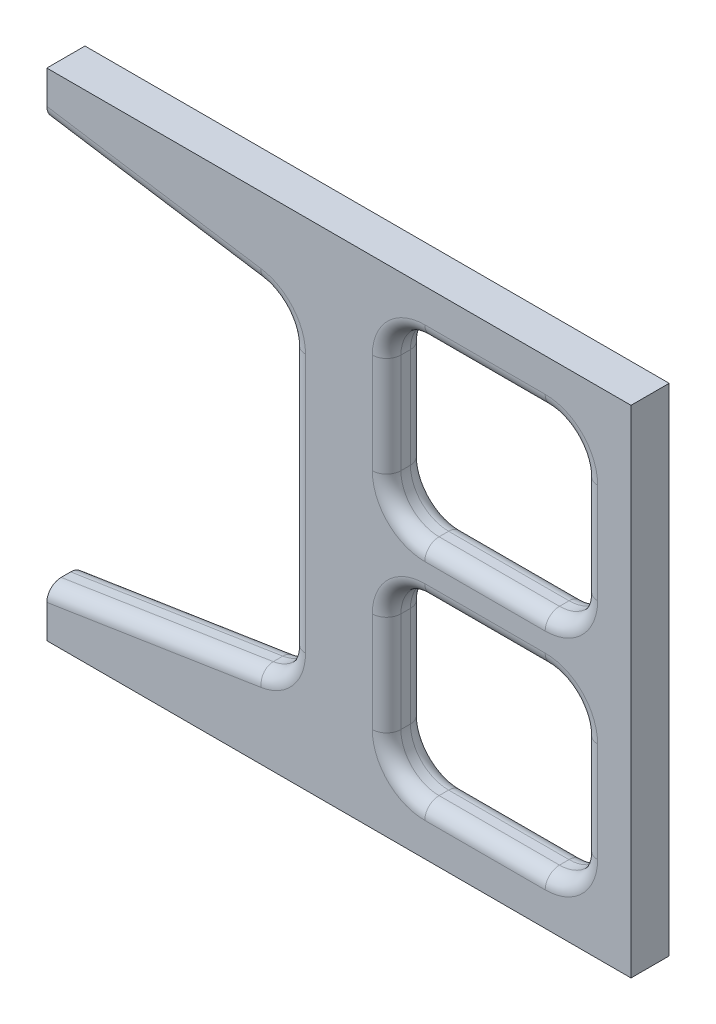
SolidWorks part; units mm, degrees
ref_plane "Спереди" through (0, 0, 0) normal (0, 0, 1) x (1, 0, 0)
ref_plane "Сверху" through (0, 0, 0) normal (0, 1, 0) x (1, 0, 0)
ref_plane "Справа" through (0, 0, 0) normal (1, 0, 0) x (0, 0, -1)
sketch "Эскиз1" plane through (0, 0, 0) normal (0, 0, 1) x (1, 0, 0)
  line L0 (-20, -54.3038) -> (-20, 54.3038)
  line L1 (-122.5, 104) -> (122.5, 104)
  line L2 (-122.5, 104) -> (-122.5, 84)
  line L3 (-122.5, -104) -> (122.5, -104)
  line L4 (122.5, 104) -> (122.5, -104)
  line L5 (-33.5323, 70.1124) -> (-122.5, 84)
  line L6 (-33.5323, -70.1124) -> (-122.5, -84)
  line L7 (-122.5, -84) -> (-122.5, -104)
  line L8 (102.5, 68) -> (102.5, 26)
  line L9 (36, 10) -> (86.5, 10)
  line L10 (-122.5, 104) -> (-122.5, -104) construction
  line L11 (20, 68) -> (20, 26)
  line L12 (36, 84) -> (86.5, 84)
  line L13 (36, -84) -> (86.5, -84)
  line L14 (-102.5, 84) -> (102.5, 84) construction
  line L15 (-102.5, 84) -> (-102.5, -84) construction
  line L16 (-102.5, -84) -> (102.5, -84) construction
  line L17 (102.5, 84) -> (102.5, -84) construction
  line L18 (36, -10) -> (86.5, -10)
  line L19 (20, -26) -> (20, -68)
  line L20 (102.5, -26) -> (102.5, -68)
  arc A0 (-20, 54.3038) -> (-33.5323, 70.1124) centre (-36, 54.3038) ccw
  arc A1 (-20, -54.3038) -> (-33.5323, -70.1124) centre (-36, -54.3038) cw
  arc A2 (36, 10) -> (20, 26) centre (36, 26) cw
  arc A3 (86.5, 10) -> (102.5, 26) centre (86.5, 26) ccw
  arc A4 (20, 68) -> (36, 84) centre (36, 68) cw
  arc A5 (102.5, 68) -> (86.5, 84) centre (86.5, 68) ccw
  arc A6 (86.5, -84) -> (102.5, -68) centre (86.5, -68) ccw
  arc A7 (20, -68) -> (36, -84) centre (36, -68) ccw
  arc A8 (36, -10) -> (20, -26) centre (36, -26) ccw
  arc A9 (86.5, -10) -> (102.5, -26) centre (86.5, -26) cw
  point P0 (0, 0)
  point P10 (-122.5, 84)
  point P11 (-122.5, -84)
  point P18 (-20, 68)
  point P19 (-20, -68)
  point P22 (-20, 68)
  point P34 (20, -84)
  point P36 (-20, -68)
  point P49 (102.5, -10)
  dimension "D4" = 16
  dimension "D5" = 16
  dimension "D6" = 16
  dimension "D7" = 16
  dimension "D8" = 16
  dimension "D9" = 16
  dimension "D10" = 16
  dimension "D11" = 16
  dimension "D3" = 16
  dimension "D12" = 16
  dimension "D1" = 245
  dimension "D2" = 208
extrude "Бобышка-Вытянуть1" add sketch "Эскиз1" along normal blind 16
fillet "Скругление2" radius 6 16 edges at (24.6863, 79.3137, 0) (61.25, 84, 0) (97.8137, 79.3137, 0) (102.5, 47, 0) (24.6863, 79.3137, 16) (61.25, 84, 16) (97.8137, 79.3137, 16) (102.5, 47, 16) (20, 47, 0) (20, 47, 16) (97.8137, 14.6863, 0) (61.25, 10, 0) (24.6863, 14.6863, 0) (97.8137, 14.6863, 16) (61.25, 10, 16) (24.6863, 14.6863, 16)
fillet "Скругление3" radius 6 10 edges at (-78.0162, 77.0562, 0) (-23.8451, 64.7085, 0) (-78.0162, -77.0562, 0) (-23.8451, -64.7085, 0) (-78.0162, -77.0562, 16) (-23.8451, -64.7085, 16) (-20, 0, 16) (-23.8451, 64.7085, 16) (-20, 0, 0) (-78.0162, 77.0562, 16)
fillet "Скругление4" radius 6 16 edges at (24.6863, -14.6863, 0) (61.25, -10, 0) (97.8137, -14.6863, 0) (102.5, -47, 0) (97.8137, -79.3137, 0) (61.25, -84, 0) (24.6863, -79.3137, 0) (97.8137, -14.6863, 16) (102.5, -47, 16) (97.8137, -79.3137, 16) (61.25, -84, 16) (24.6863, -79.3137, 16) (20, -47, 16) (24.6863, -14.6863, 16) (20, -47, 0) (61.25, -10, 16)
